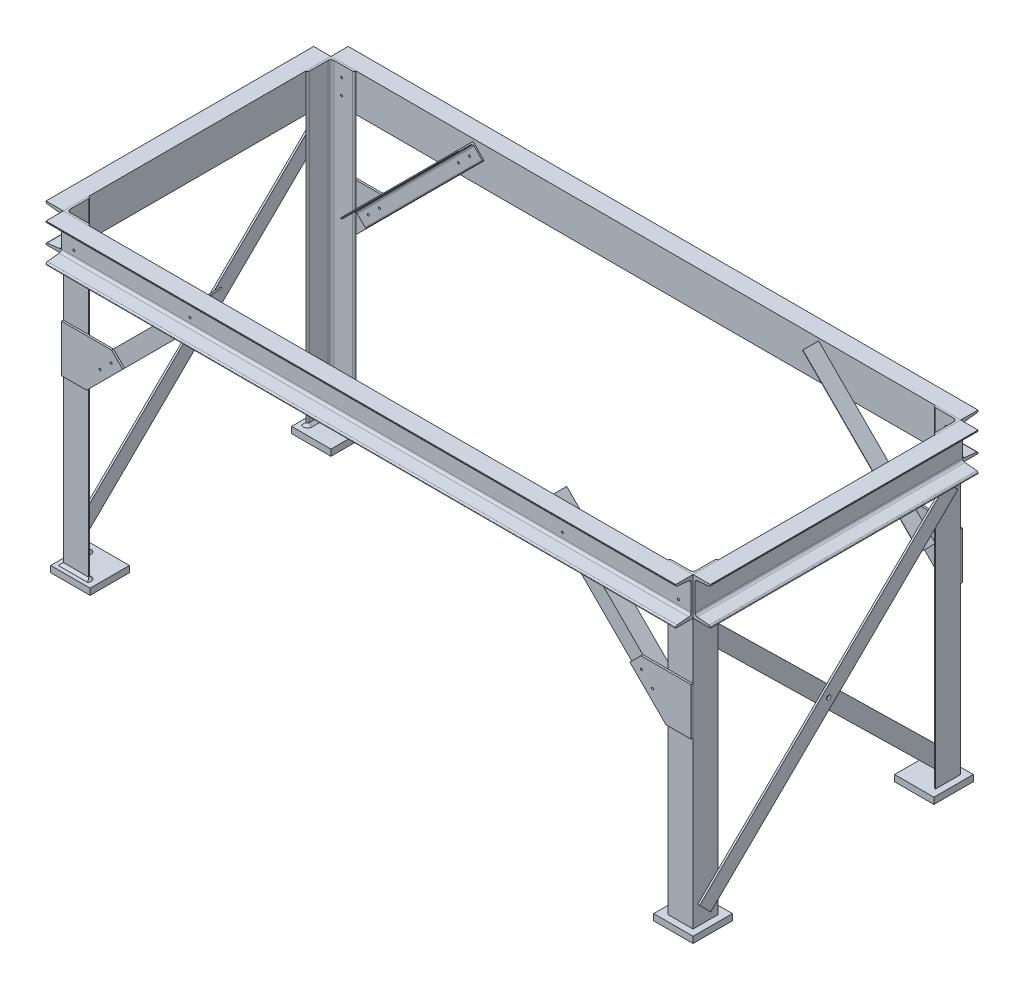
SolidWorks part; units mm, degrees
other "DetailItem1"
other "DetailItem2"
other "DetailItem3"
other "DetailItem4"
other "DetailItem5"
other "DetailItem6"
other "DetailItem7"
other "DetailItem8"
other "DetailItem9"
other "DetailItem10"
other "Weld Folder"
other "Weld Bead1"
other "Weld Bead2"
other "Weld Bead3"
other "Weld Bead4"
other "Weld Bead5"
other "Weld Bead8"
other "Weld Bead9"
other "Weld Bead10"
other "Weld Bead6"
other "Weld Bead7"
ref_plane "Front Plane" through (0, 0, 0) normal (0, 0, 1) x (1, 0, 0)
ref_plane "Top Plane" through (0, 0, 0) normal (0, 1, 0) x (1, 0, 0)
ref_plane "Right Plane" through (0, 0, 0) normal (1, 0, 0) x (0, 0, -1)
ref_plane "Top of Frame Plane" through (0, 1000, 0) normal (0, 1, 0) x (1, 0, 0)
sketch "Top of Frame Sketch" plane through (0, 1000, 0) normal (0, 1, 0) x (1, 0, 0)
  line L1 (1000, -425) -> (-1000, -425)
  line L2 (1000, -425) -> (1000, 425)
  line L3 (1000, 425) -> (-1000, 425)
  line L4 (-1000, -425) -> (-1000, 425)
  line L5 (1000, -425) -> (-1000, 425) construction
  line L6 (1000, 425) -> (-1000, -425) construction
  point P0 (0, 0)
  dimension "D1" = 2000
  dimension "D2" = 850
ref_plane "Leg Plane" through (0, 0, 425) normal (0, 0, 1) x (1, 0, 0)
sketch "Leg Sketch" plane through (0, 0, 425) normal (0, 0, 1) x (1, 0, 0)
  line L0 (-1000, 1000) -> (-1000, 25)
  dimension "D1" = 975
other "C channel CH 120 X 12(1)"
ref_plane "Plane3" through (1000, 880, 425) normal (-1, 0, 0) x (0, 0, 1)
sketch "Sketch1" plane through (1000, 880, 425) normal (-1, 0, 0) x (0, 0, 1)
  line L0 (55, 120) -> (0, 120)
  line L1 (55, 0) -> (0, 0)
  line L2 (0, 120) -> (0, 0)
  line L5 (0, 8.5) -> (30.8145, 8.5) construction
  line L6 (55, 120) -> (55, 118.1111)
  line L7 (55, 0) -> (55, 1.8889)
  line L12 (6.3, 101.7375) -> (6.3, 18.2625)
  line L17 (13.4638, 109.6937) -> (50.9704, 113.6358)
  line L18 (13.4638, 10.3063) -> (50.9704, 6.3642)
  arc A0 (50.9704, 113.6358) -> (55, 118.1111) centre (50.5, 118.1111) ccw
  arc A1 (50.9704, 6.3642) -> (55, 1.8889) centre (50.5, 1.8889) cw
  arc A9 (6.3, 18.2625) -> (13.4638, 10.3063) centre (14.3, 18.2625) ccw
  arc A10 (6.3, 101.7375) -> (13.4638, 109.6937) centre (14.3, 101.7375) cw
  point P10 (27.5, 120)
  point P11 (27.5, 0)
  point P12 (6.3, 60)
  point P13 (0, 60)
  point P14 (0, 0)
  dimension "RI" = 8
  dimension "D2" = 6
  dimension "RA" = 4.5
  dimension "D3" = 18.2625
  dimension "Depth" = 120
  dimension "BF" = 55
  dimension "TW" = 6.3
  dimension "TF" = 8.5
  dimension "d1" = 83.475
other "L angle (equal) 80X80X6(2)"
ref_plane "Plane4" through (-1000, 1000, 425) normal (0, -1, 0) x (0, 0, -1)
sketch "Sketch11" plane through (-1000, 1000, 425) normal (0, -1, 0) x (0, 0, -1)
  line L0 (0, 80) -> (0, 0)
  line L2 (6, 74) -> (6, 16)
  line L3 (16, 6) -> (74, 6)
  line L5 (80, 0) -> (0, 0)
  arc A0 (6, 74) -> (0, 80) centre (0, 74) ccw
  arc A1 (80, 0) -> (74, 6) centre (74, 0) ccw
  arc A2 (16, 6) -> (6, 16) centre (16, 16) cw
  point P8 (0, 40)
  point P9 (40, 0)
  point P10 (0, 0)
  dimension "Radius_2" = 6
  dimension "Radius_1" = 10
  dimension "V_leg" = 80
  dimension "H_leg" = 80
  dimension "thickness" = 6
sketch "Sketch12" plane through (0, 0, 425) normal (0, 0, 1) x (1, 0, 0)
  line L0 (-1000, 700) -> (-1000, 550)
  line L1 (-1000, 25) -> (-1000, 1000) construction
  line L2 (-1000, 550) -> (-920, 550)
  line L3 (-920, 25) -> (-920, 1000) construction
  line L4 (-920, 550) -> (-805.3553, 664.6447)
  line L5 (-805.3553, 664.6447) -> (-840.7107, 700)
  line L6 (-840.7107, 700) -> (-1000, 700)
  line L7 (-1055, 1000) -> (-1000, 1000) construction
  dimension "D1" = 150
  dimension "D2" = 45
  dimension "D3" = 50
  dimension "D4" = 450
extrude "Reinforcing Plate" add sketch "Sketch12" along normal blind 6 separate body
sketch "Angled Brace Sketch" plane through (0, 0, 425) normal (0, 0, -1) x (-1, 0, 0)
  line L0 (548.7689, 991.9417) -> (920, 620.7107)
  line L1 (920, 25) -> (920, 1000) construction
  line L3 (920, 550) -> (805.3553, 664.6447) construction
  dimension "D1" = 525
other "L angle (equal) 50X50X4(1)"
ref_plane "Plane5" through (-548.7689, 991.9417, 425) normal (-0.7071, -0.7071, 0) x (0, 0, -1)
sketch "Sketch14" plane through (-548.7689, 991.9417, 425) normal (-0.7071, -0.7071, 0) x (0, 0, -1)
  line L0 (0, 50) -> (0, 0)
  line L2 (4, 46) -> (4, 11)
  line L3 (11, 4) -> (46, 4)
  line L5 (50, 0) -> (0, 0)
  arc A0 (4, 46) -> (0, 50) centre (0, 46) ccw
  arc A1 (50, 0) -> (46, 4) centre (46, 0) ccw
  arc A2 (11, 4) -> (4, 11) centre (11, 11) cw
  point P8 (0, 25)
  point P9 (25, 0)
  point P10 (0, 0)
  dimension "Radius_2" = 4
  dimension "Radius_1" = 7
  dimension "V_leg" = 50
  dimension "H_leg" = 50
  dimension "thickness" = 4
sketch "Sketch15" plane through (0, 25, 0) normal (0, -1, 0) x (1, 0, 0)
  line L0 (-920, 425) -> (-1000, 425) construction
  line L1 (-1020, 445) -> (-895, 445)
  line L2 (-1020, 445) -> (-1020, 320)
  line L3 (-1020, 320) -> (-895, 320)
  line L4 (-895, 445) -> (-895, 320)
  line L5 (-1000, 425) -> (-1000, 345) construction
  point P6 (-960, 425)
  point P9 (-1000, 385)
  dimension "D1" = 125
  dimension "D2" = 125
  dimension "D3" = 20
  dimension "D4" = 20
extrude "Foot Plate" add sketch "Sketch15" along normal blind 20 separate body
other "Fillet Bead1" parameters "D10"=6, "D11"=8, "D12"=0, "D13"=3, "D14"=0
mirror "Mirror1" about plane through (0, 0, 0) normal (0, 0, 1)
sketch "Sketch16" plane through (-1000, 0, 0) normal (-1, 0, 0) x (0, 0, 1)
  line L0 (-410, 819.289) -> (375.0039, 50)
  line L1 (-410, 819.289) -> (-375.0039, 855)
  line L2 (375.0039, 50) -> (410, 85.711)
  line L3 (-375.0039, 855) -> (410, 85.711)
  line L4 (425, 25) -> (425, 1000) construction
  line L5 (445, 25) -> (320, 25) construction
  line L6 (-425, 25) -> (-425, 1000) construction
  line L7 (-425, 880) -> (-480, 880) construction
  dimension "D1" = 50
  dimension "D2" = 15
  dimension "D3" = 25
  dimension "D4" = 15
  dimension "D5" = 25
extrude "Cross Brace 1" add sketch "Sketch16" along normal blind 6 separate body
sketch "Sketch17" plane through (-994, 0, 0) normal (1, 0, 0) x (0, 0, -1)
  line L0 (-410, 819.289) -> (375.0039, 50)
  line L1 (-410, 819.289) -> (-375.0039, 855)
  line L2 (375.0039, 50) -> (410, 85.711)
  line L3 (-375.0039, 855) -> (410, 85.711)
  line L4 (425, 880) -> (-425, 880) construction
  line L5 (-425, 25) -> (-425, 1000) construction
  line L6 (445, 25) -> (320, 25) construction
  line L7 (425, 25) -> (425, 1000) construction
  dimension "D1" = 50
  dimension "D2" = 25
  dimension "D3" = 15
  dimension "D4" = 25
  dimension "D5" = 15
extrude "Cross Brace 2" add sketch "Sketch17" along normal blind 6 separate body
hole_wizard "M12 Clearance Hole1" positions "Sketch18" profile "Sketch19" hole size "M12" standard "ANSI Metric"
sketch "Sketch18" plane through (-1006, 0, 0) normal (-1, 0, 0) x (0, 0, 1)
  line L0 (17.498, 470.3555) -> (-17.498, 434.6445) construction
  line L1 (410, 85.711) -> (-375.0039, 855) construction
  line L2 (-410, 819.289) -> (375.0039, 50) construction
  point P0 (0, 452.5)
sketch "Sketch19" plane through (-1006, 452.5, 0) normal (0, 1, 0) x (0, 0, 1)
  line L0 (0, 0) -> (0, 2061)
  line L1 (0, 2061) -> (6.75, 2061)
  line L2 (6.75, 2061) -> (6.75, 0)
  line L5 (6.75, 0) -> (0, 0)
  line L11 (0, -6.35) -> (0, 107.95) construction
  dimension "Thru Hole Dia." = 13.5
  dimension "Thru Hole Depth" = 2061
mirror "Mirror2" about plane through (0, 0, 0) normal (1, 0, 0)
hole_wizard "M6 Clearance Hole1" positions "Sketch20" profile "Sketch21" hole size "M6" standard "ANSI Metric"
sketch "Sketch20" plane through (0, 0, 431.3) normal (0, 0, 1) x (1, 0, 0)
  line L0 (-902.3223, 603.033) -> (-531.0913, 974.2641) construction
  line L3 (-960, 965) -> (-960, 915) construction
  line L5 (-884.6447, 585.3553) -> (-513.4136, 956.5864) construction
  line L6 (-513.4136, 956.5864) -> (-548.7689, 991.9417) construction
  line L7 (-884.6447, 585.3553) -> (-920, 620.7107) construction
  line L8 (-1000, 898.2625) -> (-1000, 981.7375) construction
  line L9 (-1000, 1000) -> (1000, 1000) construction
  point P6 (-960, 965)
  point P7 (-960, 915)
  point P14 (-531.0913, 974.2641)
  point P27 (-877.5736, 627.7817)
  point P29 (-842.2183, 663.1371)
  point P31 (-591.1953, 914.16)
  point P33 (-555.84, 949.5153)
  dimension "D1" = 40
  dimension "D2" = 50
  dimension "D3" = 35
  dimension "D4" = 50
  dimension "D5" = 50
  dimension "D6" = 35
  dimension "D7" = 35
sketch "Sketch21" plane through (-960, 965, 431.3) normal (1, 0, 0) x (0, -1, 0)
  line L0 (0, 0) -> (0, 911.3)
  line L1 (0, 911.3) -> (3.3, 911.3)
  line L2 (3.3, 911.3) -> (3.3, 0)
  line L5 (3.3, 0) -> (0, 0)
  line L11 (0, -6.35) -> (0, 107.95) construction
  dimension "Thru Hole Dia." = 6.6
  dimension "Thru Hole Depth" = 911.3
mirror "Mirror3" about plane through (0, 0, 0) normal (1, 0, 0) of "M6 Clearance Hole1"
